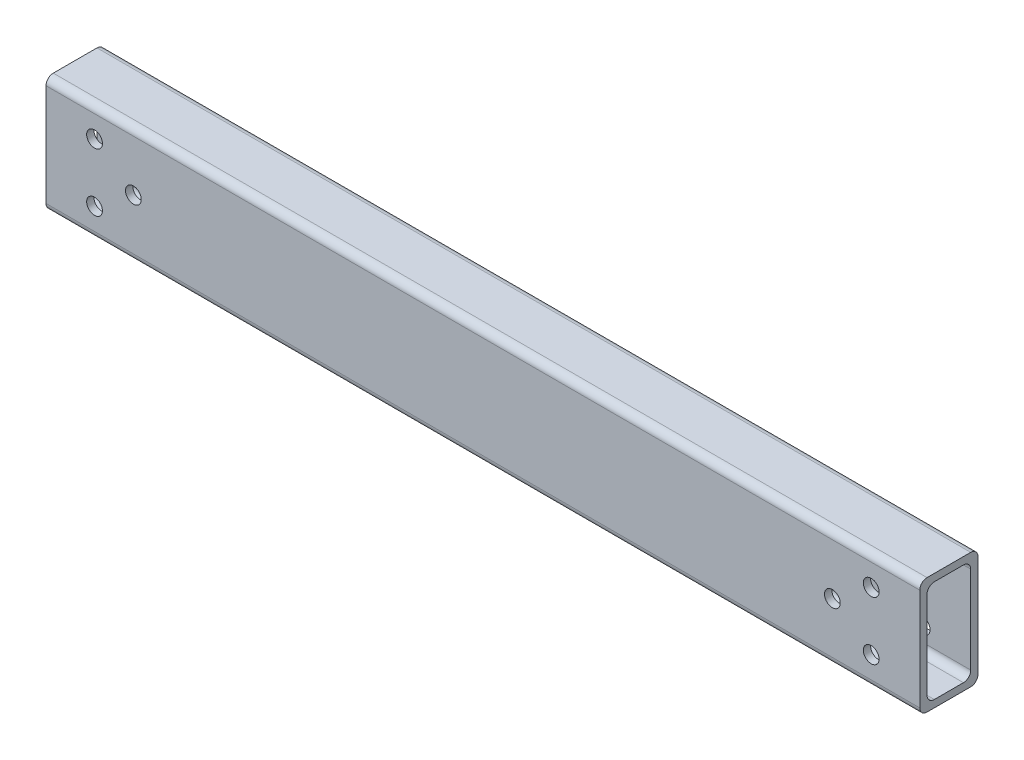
SolidWorks part; units mm, degrees
ref_plane "Front Plane" through (0, 0, 0) normal (0, 0, 1) x (1, 0, 0)
ref_plane "Top Plane" through (0, 0, 0) normal (0, 1, 0) x (1, 0, 0)
ref_plane "Right Plane" through (0, 0, 0) normal (1, 0, 0) x (0, 0, -1)
sketch "Sketch1" plane through (0, 0, 0) normal (0, 0, 1) x (1, 0, 0)
  line L1 (0, 0) -> (-1143, 0)
  line L2 (0, 0) -> (0, -152.4)
  line L3 (0, -152.4) -> (-1143, -152.4)
  line L4 (-1143, 0) -> (-1143, -152.4)
  dimension "D1" = 152.4
  dimension "D2" = 1143
extrude "Extrude1" add sketch "Sketch1" along normal blind 76.2
sketch "Sketch2" plane through (0, 0, 0) normal (1, 0, 0) x (0, 0, -1)
  line L0 (-76.2, -152.4) -> (-76.2, 0) construction
  line L1 (-66.675, -9.525) -> (-9.525, -9.525)
  line L2 (-66.675, -9.525) -> (-66.675, -142.875)
  line L3 (-66.675, -142.875) -> (-9.525, -142.875)
  line L4 (-9.525, -9.525) -> (-9.525, -142.875)
  line L5 (-76.2, -152.4) -> (0, -152.4) construction
  dimension "D1" = 9.525
  dimension "D2" = 66.675
  dimension "D3" = 9.525
  dimension "D4" = 142.875
extrude "Cut-Extrude1" cut sketch "Sketch2" against normal blind 1143
fillet "Fillet1" radius 9.525 8 edges at (-571.5, -9.525, 9.525) (-571.5, -9.525, 66.675) (-571.5, -142.875, 66.675) (-571.5, -152.4, 0) (-571.5, 0, 0) (-571.5, 0, 76.2) (-571.5, -152.4, 76.2) (-571.5, -142.875, 9.525)
sketch "Sketch3" plane through (0, 0, 0) normal (0, 0, -1) x (-1, 0, 0)
  line L0 (1143, -9.525) -> (1143, -142.875) construction
  line L1 (0, -142.875) -> (1143, -142.875) construction
  circle A0 centre (63.5, -38.1) radius 10.3187
  dimension "D1" = 20.6375
  dimension "D2" = 1079.5
  dimension "D3" = 104.775
extrude "Cut-Extrude2" cut sketch "Sketch3" against normal blind 76.2
ref_plane "Plane1" through (0, -76.2, 0) normal (0, 1, 0) x (-1, 0, 0)
mirror "Mirror1" about plane through (0, -76.2, 0) normal (0, 1, 0) of "Cut-Extrude2"
sketch "Sketch6" plane through (0, 0, 0) normal (0, 0, -1) x (-1, 0, 0)
  line L0 (41.91, -76.2) -> (-41.91, -76.2) construction
  line L1 (0, -142.875) -> (0, -9.525) construction
  circle A0 centre (114.3, -76.2) radius 10.3188
  dimension "D1" = 20.6375
  dimension "D2" = 114.3
extrude "Cut-Extrude3" cut sketch "Sketch6" against normal blind 76.2
ref_plane "Plane2" through (-571.5, 0, 0) normal (1, 0, 0) x (0, 0, -1)
mirror "Mirror2" about plane through (-571.5, 0, 0) normal (1, 0, 0) of "Mirror1", "Cut-Extrude3", "Cut-Extrude2"
